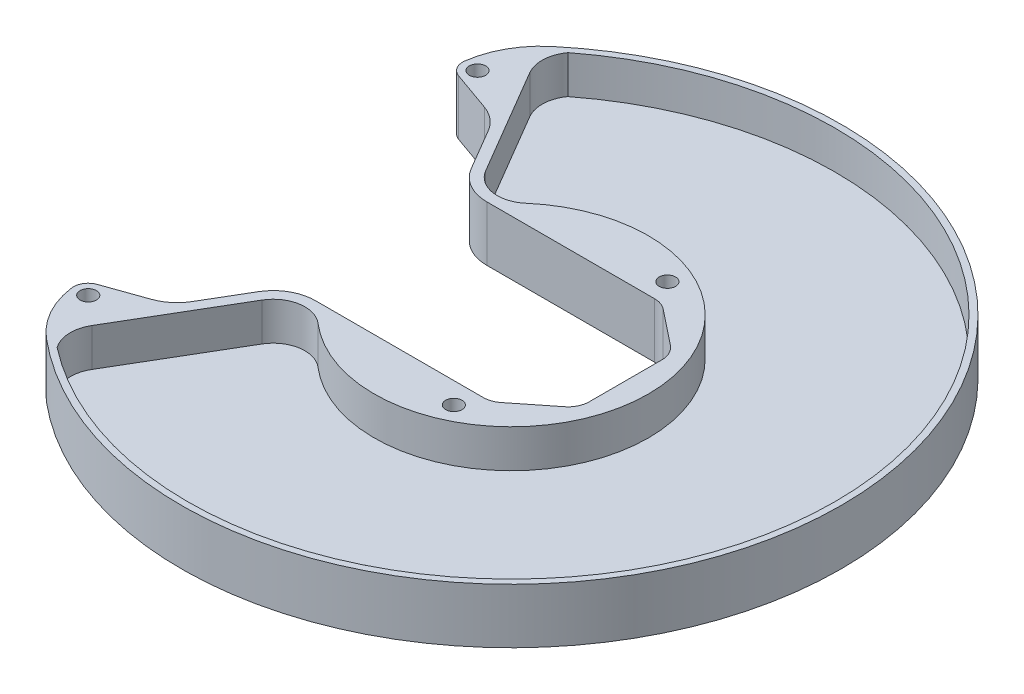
SolidWorks part; units mm, degrees
ref_plane "Front Plane" through (0, 0, 0) normal (0, 0, 1) x (1, 0, 0)
ref_plane "Top Plane" through (0, 0, 0) normal (0, 1, 0) x (1, 0, 0)
ref_plane "Right Plane" through (0, 0, 0) normal (1, 0, 0) x (0, 0, -1)
sketch "Sketch1" plane through (0, 0, 0) normal (0, 1, 0) x (1, 0, 0)
  line L0 (0, 0) -> (34.29, 0) construction
  line L8 (34.29, -13.97) -> (34.29, 13.97)
  line L12 (19.5169, 25.7024) -> (34.29, 13.97)
  line L15 (19.5169, -25.7024) -> (-33.0714, -25.7024)
  line L16 (19.5169, -25.7024) -> (34.29, -13.97)
  line L18 (19.5169, 25.7024) -> (-33.0714, 25.7024)
  line L20 (-67.7301, 72.2877) -> (-44.019, 31.9649)
  line L22 (-67.7301, -72.2877) -> (-44.019, -31.9649)
  line L24 (-59.5332, 66.1151) -> (-42.881, 37.7966) construction
  line L25 (-60.19, 65.7288) -> (-41.2821, 33.5742)
  line L26 (-60.19, -65.7288) -> (-41.2821, -33.5742)
  line L27 (41.155, 0) -> (97.155, 0) construction
  arc A0 (-67.7301, -72.2877) -> (-67.7301, 72.2877) centre (0, 0) ccw
  arc A3 (-59.6737, 76.669) -> (-59.6737, -76.669) centre (0, 0) cw
  arc A4 (-49.772, 48.0121) -> (-49.772, -48.0121) centre (0, 0) cw construction
  arc A5 (-26.8559, 31.1849) -> (-41.2821, 33.5742) centre (-33.0714, 38.4024) cw
  arc A6 (-44.019, 31.9649) -> (-33.0714, 25.7024) centre (-33.0714, 38.4024) ccw
  arc A11 (-44.019, -31.9649) -> (-33.0714, -25.7024) centre (-33.0714, -38.4024) cw
  circle A12 centre (-51.5596, 70.8038) radius 9.25 construction
  circle A13 centre (-32.942, 39.143) radius 9.25 construction
  arc A14 (-59.6737, 76.669) -> (-60.19, 65.7288) centre (-51.5596, 70.8038) ccw
  arc A16 (-41.2821, -33.5742) -> (-26.8559, -31.1849) centre (-33.0714, -38.4024) cw
  arc A17 (-59.6737, -76.669) -> (-60.19, -65.7288) centre (-51.5596, -70.8038) cw
  arc A18 (-26.8559, 31.1849) -> (-26.8559, -31.1849) centre (0, 0) cw
  point P23 (-33.0714, -25.4)
  point P24 (-33.0714, -25.4)
  point P48 (69.155, 0)
  dimension "D1" = 198.12
  dimension "D4" = 34.29
  dimension "D5" = 1.905
  dimension "D6" = 9.525
  dimension "D10" = 0.762
  dimension "D11" = 56
  dimension "D3" = 27.94
  dimension "D8" = 0.762
  dimension "D9" = 3.175
  dimension "D13" = 56
  dimension "D14" = 8.89
extrude "Boss-Extrude1" add sketch "Sketch1" along normal blind 16.51
sketch "Sketch4" plane through (0, 0, 0) normal (0, -1, 0) x (1, 0, 0)
  line L7 (19.5169, -25.7024) -> (-33.0714, -25.7024)
  line L8 (19.5169, -25.7024) -> (-33.0714, -25.7024)
  line L9 (-33.0714, 25.7024) -> (19.5169, 25.7024)
  line L10 (-33.0714, 25.7024) -> (19.5169, 25.7024)
  line L30 (19.5169, 25.7024) -> (34.29, 13.97)
  line L31 (34.29, 13.97) -> (34.29, -13.97)
  line L32 (34.29, -13.97) -> (19.5169, -25.7024)
  line L35 (-44.019, -31.9649) -> (-67.7301, -72.2877)
  line L36 (-67.7301, 72.2877) -> (-44.019, 31.9649)
  line L39 (19.5169, 25.7024) -> (34.29, 13.97)
  line L40 (34.29, 13.97) -> (34.29, -13.97)
  line L41 (34.29, -13.97) -> (19.5169, -25.7024)
  line L44 (-44.019, -31.9649) -> (-67.7301, -72.2877)
  line L45 (-67.7301, 72.2877) -> (-44.019, 31.9649)
  arc A3 (-33.0714, -25.7024) -> (-44.019, -31.9649) centre (-33.0714, -38.4024) ccw
  arc A4 (-33.0714, -25.7024) -> (-44.019, -31.9649) centre (-33.0714, -38.4024) ccw
  arc A5 (-44.019, 31.9649) -> (-33.0714, 25.7024) centre (-33.0714, 38.4024) ccw
  arc A6 (-44.019, 31.9649) -> (-33.0714, 25.7024) centre (-33.0714, 38.4024) ccw
  arc A16 (-67.7301, -72.2877) -> (-67.7301, 72.2877) centre (0, 0) ccw
  arc A19 (-67.7301, -72.2877) -> (-67.7301, 72.2877) centre (0, 0) ccw
  dimension "D1" = 0
extrude "Boss-Extrude2" add sketch "Sketch4" against normal blind 5.08
fillet "Fillet1" radius 6.35 6 edges at (-67.7301, 8.255, 72.2877) (34.29, 8.255, 13.97) (34.29, 8.255, -13.97) (-67.7301, 8.255, -72.2877) (19.5169, 8.255, 25.7024) (19.5169, 8.255, -25.7024)
sketch "Sketch5" plane through (0, 16.51, 0) normal (0, 1, 0) x (1, 0, 0)
  line L0 (-70.0632, 54.2298) -> (-58.0703, 49.9846)
  line L1 (-65.0836, 67.787) -> (-44.019, 31.9649) construction
  line L2 (-51.3606, 44.45) -> (-65.0836, 67.787)
  arc A3 (-72.9842, 59.0206) -> (-63.6926, 75.8692) centre (-46.5184, 55.4117) cw
  arc A4 (-58.0703, 49.9846) -> (-51.3606, 44.45) centre (-62.3082, 38.0125) cw
  arc A5 (-63.6926, 75.8692) -> (-65.0836, 67.787) centre (-59.6098, 71.0058) ccw
  arc A6 (-63.6926, 75.8692) -> (-65.0836, 67.787) centre (-59.6098, 71.0058) ccw construction
  arc A7 (-72.9842, 59.0206) -> (-70.0632, 54.2298) centre (-68.58, 58.42) ccw
  arc A8 (-63.6926, -75.8692) -> (-63.6926, 75.8692) centre (0, 0) ccw construction
  point P6 (-62.4537, 75.8692)
  point P11 (-73.025, 58.42)
  point P13 (-64.8838, 67.4473)
  dimension "D1" = 4.445
  dimension "D3" = 12.7
  dimension "D4" = 44.45
  dimension "D5" = 58.42
  dimension "D2" = 68.58
extrude "Boss-Extrude3" add sketch "Sketch5" against normal up to surface (16.51 mm away)
mirror "Mirror1" about plane through (0, 0, 0) normal (0, 0, 1) of "Boss-Extrude3"
hole_wizard "#10 (0.1935) Diameter Hole1" positions "Sketch7" profile "Sketch8" hole size "#10" standard "ANSI Inch"
sketch "Sketch7" plane through (0, 16.51, 0) normal (0, 1, 0) x (1, 0, 0)
  line L2 (0, 0) -> (17.8841, 0) construction
  line L3 (14.7984, 38.4024) -> (14.7984, 25.7024) construction
  line L4 (-33.0714, 25.7024) -> (17.3021, 25.7024) construction
  arc A4 (-72.9842, 59.0206) -> (-70.0632, 54.2298) centre (-68.58, 58.42) ccw construction
  arc A5 (-70.0632, -54.2298) -> (-72.9842, -59.0206) centre (-68.58, -58.42) ccw construction
  arc A6 (-26.8559, -31.1849) -> (-26.8559, 31.1849) centre (0, 0) ccw construction
  point P0 (-68.58, 58.42)
  point P3 (-68.58, -58.42)
  point P5 (14.7984, -32.0524)
  point P7 (14.7984, 32.0524)
  point P56 (0, 0)
  dimension "D1" = 12.7
sketch "Sketch8" plane through (-68.58, 16.51, -58.42) normal (1, 0, 0) x (0, 0, 1)
  line L0 (0, 0) -> (0, 16.51)
  line L1 (0, 16.51) -> (2.4574, 16.51)
  line L2 (2.4574, 16.51) -> (2.4574, 0)
  line L5 (2.4574, 0) -> (0, 0)
  line L11 (0, -6.35) -> (0, 107.95) construction
  dimension "Thru Hole Dia." = 4.9149
  dimension "Thru Hole Depth" = 16.51
